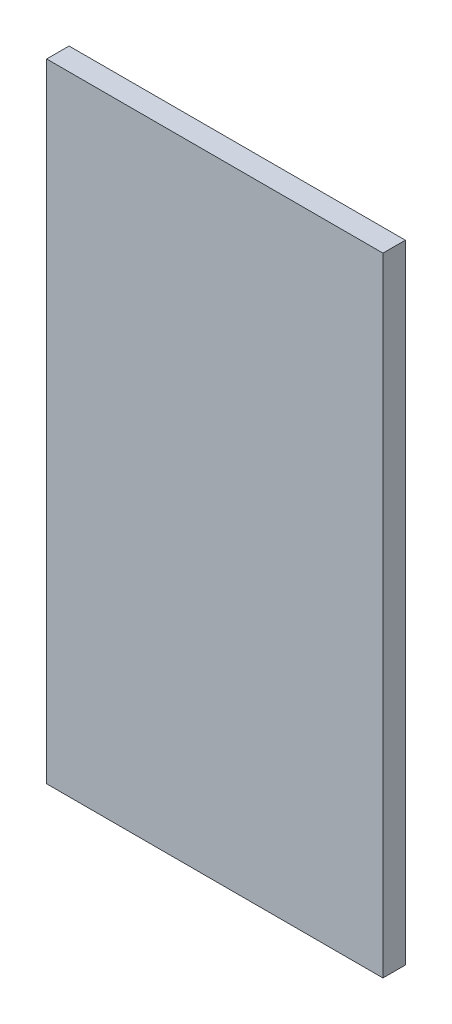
SolidWorks part; units mm, degrees
ref_plane "Front Plane" through (0, 0, 0) normal (0, 0, 1) x (1, 0, 0)
ref_plane "Top Plane" through (0, 0, 0) normal (0, 1, 0) x (1, 0, 0)
ref_plane "Right Plane" through (0, 0, 0) normal (1, 0, 0) x (0, 0, -1)
sketch "Sketch1" plane through (0, 0, 0) normal (0, 0, 1) x (1, 0, 0)
  line L1 (0, 0) -> (190.5, 0)
  line L2 (0, 0) -> (0, 355.6)
  line L3 (0, 355.6) -> (190.5, 355.6)
  line L4 (190.5, 0) -> (190.5, 355.6)
  dimension "D1" = 190.5
  dimension "D2" = 355.6
extrude "Extrude1" add sketch "Sketch1" along normal blind 12.7
